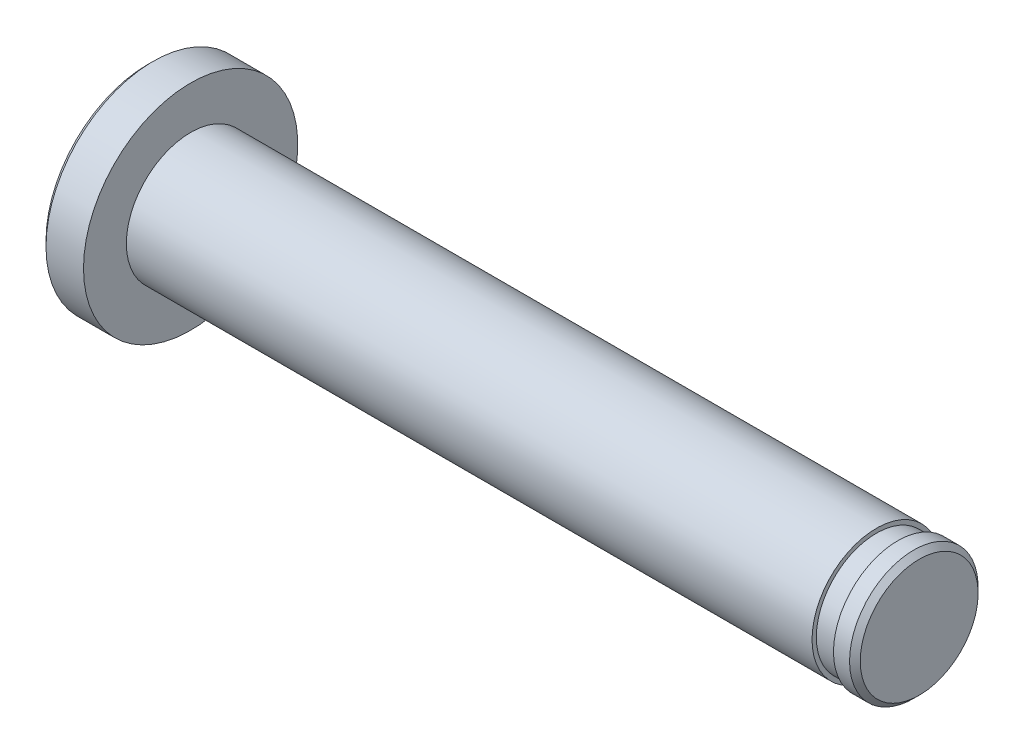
SolidWorks part; units mm, degrees
ref_plane "Plan1" through (0, 0, 0) normal (0, 0, 1) x (1, 0, 0)
ref_plane "Plan2" through (0, 0, 0) normal (0, 1, 0) x (1, 0, 0)
ref_plane "Plan3" through (0, 0, 0) normal (1, 0, 0) x (0, 0, -1)
sketch "Esquisse1" plane through (0, 0, 0) normal (0, 0, 1) x (1, 0, 0)
  line L0 (0, 0) -> (72, 0) construction
  line L1 (-2, 0) -> (-2, 4.75)
  line L2 (-1.75, 5) -> (0, 5)
  line L3 (0, 5) -> (0, 3)
  line L4 (0, 3) -> (32, 3)
  line L5 (32, 3) -> (32, 2.8)
  line L6 (32, 2.8) -> (33, 2.8)
  line L7 (33, 2.8) -> (33, 3)
  line L8 (33, 3) -> (33.75, 3)
  line L9 (34, 2.75) -> (34, 0)
  line L10 (34, 0) -> (-2, 0)
  line L11 (-2, 4.75) -> (-1.75, 5)
  line L12 (33.75, 3) -> (34, 2.75)
  point P4 (-2, 5)
  point P11 (34, 3)
  dimension "D1" = 6
  dimension "D2" = 1
  dimension "D5" = 5.6
  dimension "D6" = 32
  dimension "D7" = 2
  dimension "D8" = 10
  dimension "D9" = 1
revolve "Base-Révolution" add sketch "Esquisse1" angle 360 about L0
